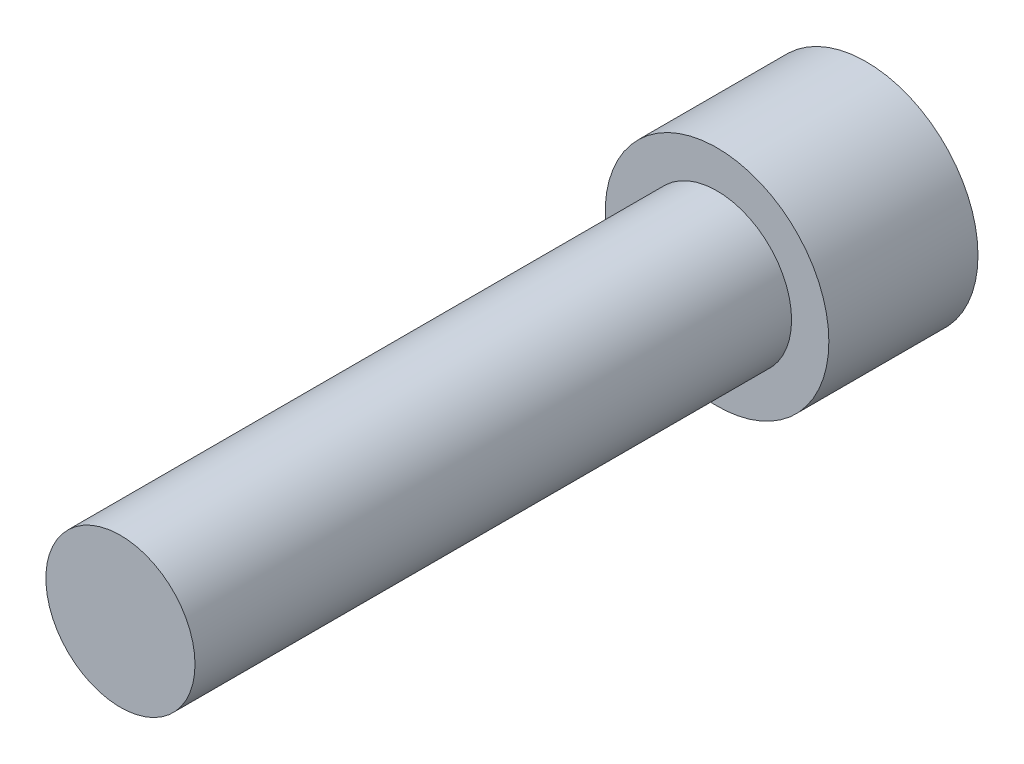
SolidWorks part; units mm, degrees
ref_plane "Front Plane" through (0, 0, 0) normal (0, 0, 1) x (1, 0, 0)
ref_plane "Top Plane" through (0, 0, 0) normal (0, 1, 0) x (1, 0, 0)
ref_plane "Right Plane" through (0, 0, 0) normal (1, 0, 0) x (0, 0, -1)
sketch "Sketch6" plane through (0, 0, 0) normal (1, 0, 0) x (0, 0, -1)
  line L0 (-25.4, 0) -> (22.525, 0) construction
  line L1 (5.2388, 0) -> (-5.2388, 0) construction
  line L2 (-25.4, 0) -> (-25.4, -3.175)
  line L3 (-25.4, -3.175) -> (0, -3.175)
  line L4 (0, 5.2388) -> (0, -5.2388) construction
  line L5 (0, -3.175) -> (0, -4.7625)
  line L6 (0, -4.7625) -> (6.35, -4.7625)
  line L7 (6.35, -4.7625) -> (6.35, 0)
  line L8 (6.35, 0) -> (-25.4, 0)
  dimension "L" = 25.4
  dimension "H" = 6.35
  dimension "A" = 9.525
  dimension "D" = 6.35
revolve "Revolve1" add sketch "Sketch6" angle 360 about L0
sketch "Sketch7" plane through (0, 0, -6.35) normal (0, 0, -1) x (-1, 0, 0)
  line L2 (-2.3876, 1.3785) -> (-2.3876, -1.3785)
  line L4 (-2.3876, -1.3785) -> (0, -2.757)
  line L5 (0, -2.757) -> (2.3876, -1.3785)
  line L6 (2.3876, -1.3785) -> (2.3876, 1.3785)
  line L7 (2.3876, 1.3785) -> (0, 2.757)
  line L8 (0, 2.757) -> (-2.3876, 1.3785)
  circle A0 centre (0, 0) radius 2.3876 construction
  dimension "J" = 4.7752
extrude "HEX" cut sketch "Sketch7" against normal blind 3.556
